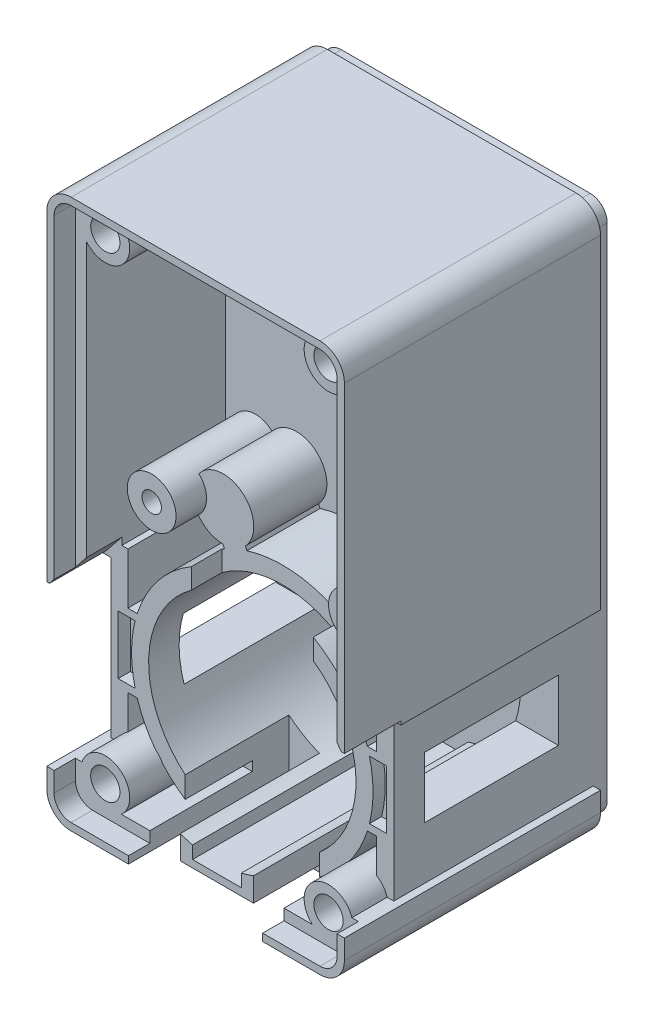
SolidWorks part; units mm, degrees
ref_plane "Face" through (0, 0, 0) normal (0, 0, 1) x (1, 0, 0)
ref_plane "Dessus" through (0, 0, 0) normal (0, 1, 0) x (1, 0, 0)
ref_plane "Droite" through (0, 0, 0) normal (1, 0, 0) x (0, 0, -1)
imported_body "Importée1"
sketch "Esquisse1" plane through (0, 0, 10.3) normal (0, 0, 1) x (1, 0, 0)
  line L6 (12.2, -29.4) -> (11.6, -29.4)
  line L7 (11.6, -29.4) -> (11.6, -31)
  line L8 (10.2, -32.4) -> (5.5, -32.4)
  line L9 (5.5, -32.4) -> (5.5, -33)
  line L10 (-10.2, 11.4) -> (10.2, 11.4)
  line L11 (11.6, 10) -> (11.6, -15.8399)
  line L12 (11.6, -15.8399) -> (11.9681, -16.3)
  line L13 (11.9681, -16.3) -> (12.2, -16.3)
  line L14 (12.2, -16.3) -> (12.2, 10)
  line L15 (10.2, 12) -> (-10.2, 12)
  line L16 (-12.2, 10) -> (-12.2, -16.3)
  line L17 (-12.2, -16.3) -> (-11.9681, -16.3)
  line L18 (-11.9681, -16.3) -> (-11.6, -15.8399)
  line L19 (-11.6, -15.8399) -> (-11.6, 10)
  line L20 (-10.2, 11.4) -> (10.2, 11.4)
  line L21 (11.6, 10) -> (11.6, -15.8399)
  line L22 (11.6, -15.8399) -> (11.9681, -16.3)
  line L23 (11.9681, -16.3) -> (12.2, -16.3)
  line L24 (12.2, -16.3) -> (12.2, 10)
  line L25 (10.2, 12) -> (-10.2, 12)
  line L26 (-12.2, 10) -> (-12.2, -16.3)
  line L27 (-12.2, -16.3) -> (-11.9681, -16.3)
  line L28 (-11.9681, -16.3) -> (-11.6, -15.8399)
  line L29 (-11.6, -15.8399) -> (-11.6, 10)
  line L30 (5.5, -33) -> (10.2, -33)
  line L31 (12.2, -31) -> (12.2, -29.4)
  line L32 (12.2, -29.4) -> (11.6, -29.4)
  line L33 (11.6, -29.4) -> (11.6, -31)
  line L34 (10.2, -32.4) -> (5.5, -32.4)
  line L35 (5.5, -32.4) -> (5.5, -33)
  line L36 (5.5, -33) -> (10.2, -33)
  line L37 (12.2, -31) -> (12.2, -29.4)
  line L38 (-11.6, -29.4) -> (-12.2, -29.4)
  line L39 (-12.2, -29.4) -> (-12.2, -31)
  line L40 (-10.2, -33) -> (-5.5, -33)
  line L41 (-5.5, -33) -> (-5.5, -32.4)
  line L42 (-5.5, -32.4) -> (-10.2, -32.4)
  line L43 (-11.6, -31) -> (-11.6, -29.4)
  line L44 (-11.6, -29.4) -> (-12.2, -29.4)
  line L45 (-12.2, -29.4) -> (-12.2, -31)
  line L46 (-10.2, -33) -> (-5.5, -33)
  line L47 (-5.5, -33) -> (-5.5, -32.4)
  line L48 (-5.5, -32.4) -> (-10.2, -32.4)
  line L49 (-11.6, -31) -> (-11.6, -29.4)
  arc A2 (10.2, -32.4) -> (11.6, -31) centre (10.2, -31) ccw
  arc A3 (10.2, -33) -> (12.2, -31) centre (10.2, -31) ccw
  arc A4 (-10.2, 11.4) -> (-11.6, 10) centre (-10.2, 10) ccw
  arc A5 (11.6, 10) -> (10.2, 11.4) centre (10.2, 10) ccw
  arc A6 (12.2, 10) -> (10.2, 12) centre (10.2, 10) ccw
  arc A7 (-10.2, 12) -> (-12.2, 10) centre (-10.2, 10) ccw
  arc A8 (-10.2, 11.4) -> (-11.6, 10) centre (-10.2, 10) ccw
  arc A9 (11.6, 10) -> (10.2, 11.4) centre (10.2, 10) ccw
  arc A10 (12.2, 10) -> (10.2, 12) centre (10.2, 10) ccw
  arc A11 (-10.2, 12) -> (-12.2, 10) centre (-10.2, 10) ccw
  arc A12 (10.2, -32.4) -> (11.6, -31) centre (10.2, -31) ccw
  arc A13 (10.2, -33) -> (12.2, -31) centre (10.2, -31) ccw
  arc A14 (-12.2, -31) -> (-10.2, -33) centre (-10.2, -31) ccw
  arc A15 (-11.6, -31) -> (-10.2, -32.4) centre (-10.2, -31) ccw
  arc A16 (-12.2, -31) -> (-10.2, -33) centre (-10.2, -31) ccw
  arc A17 (-11.6, -31) -> (-10.2, -32.4) centre (-10.2, -31) ccw
  dimension "D1" = 0
  dimension "D2" = 0
  dimension "D3" = 0
extrude "Extrusion1" add sketch "Esquisse1" along normal blind 0.15
sketch "Esquisse2" plane through (0, 0, -10.4) normal (0, 0, -1) x (-1, 0, 0)
  line L8 (10.2, 12) -> (-10.2, 12)
  line L9 (-12.2, 10) -> (-12.2, -16.6)
  line L10 (-12.2, -16.6) -> (-11.6, -16.6)
  line L11 (-11.6, -16.6) -> (-11.6, 10)
  line L12 (-10.2, 11.4) -> (10.2, 11.4)
  line L13 (11.6, 10) -> (11.6, -16.6)
  line L14 (11.6, -16.6) -> (12.2, -16.6)
  line L15 (12.2, -16.6) -> (12.2, 10)
  line L16 (10.2, 12) -> (-10.2, 12)
  line L17 (-12.2, 10) -> (-12.2, -16.6)
  line L18 (-12.2, -16.6) -> (-11.6, -16.6)
  line L19 (-11.6, -16.6) -> (-11.6, 10)
  line L20 (-10.2, 11.4) -> (10.2, 11.4)
  line L21 (11.6, 10) -> (11.6, -16.6)
  line L22 (11.6, -16.6) -> (12.2, -16.6)
  line L23 (12.2, -16.6) -> (12.2, 10)
  line L24 (10.2, -32.4) -> (-10.2, -32.4)
  line L25 (-11.6, -31) -> (-11.6, -29.4)
  line L26 (-11.6, -29.4) -> (-12.2, -29.4)
  line L27 (-12.2, -29.4) -> (-12.2, -31)
  line L28 (-10.2, -33) -> (10.2, -33)
  line L29 (12.2, -31) -> (12.2, -29.4)
  line L30 (12.2, -29.4) -> (11.6, -29.4)
  line L31 (11.6, -29.4) -> (11.6, -31)
  line L32 (10.2, -32.4) -> (-10.2, -32.4)
  line L33 (-11.6, -31) -> (-11.6, -29.4)
  line L34 (-11.6, -29.4) -> (-12.2, -29.4)
  line L35 (-12.2, -29.4) -> (-12.2, -31)
  line L36 (-10.2, -33) -> (10.2, -33)
  line L37 (12.2, -31) -> (12.2, -29.4)
  line L38 (12.2, -29.4) -> (11.6, -29.4)
  line L39 (11.6, -29.4) -> (11.6, -31)
  arc A4 (12.2, 10) -> (10.2, 12) centre (10.2, 10) ccw
  arc A5 (-10.2, 12) -> (-12.2, 10) centre (-10.2, 10) ccw
  arc A6 (-10.2, 11.4) -> (-11.6, 10) centre (-10.2, 10) ccw
  arc A7 (11.6, 10) -> (10.2, 11.4) centre (10.2, 10) ccw
  arc A8 (12.2, 10) -> (10.2, 12) centre (10.2, 10) ccw
  arc A9 (-10.2, 12) -> (-12.2, 10) centre (-10.2, 10) ccw
  arc A10 (-10.2, 11.4) -> (-11.6, 10) centre (-10.2, 10) ccw
  arc A11 (11.6, 10) -> (10.2, 11.4) centre (10.2, 10) ccw
  arc A12 (10.2, -32.4) -> (11.6, -31) centre (10.2, -31) ccw
  arc A13 (-11.6, -31) -> (-10.2, -32.4) centre (-10.2, -31) ccw
  arc A14 (-12.2, -31) -> (-10.2, -33) centre (-10.2, -31) ccw
  arc A15 (10.2, -33) -> (12.2, -31) centre (10.2, -31) ccw
  arc A16 (10.2, -32.4) -> (11.6, -31) centre (10.2, -31) ccw
  arc A17 (-11.6, -31) -> (-10.2, -32.4) centre (-10.2, -31) ccw
  arc A18 (-12.2, -31) -> (-10.2, -33) centre (-10.2, -31) ccw
  arc A19 (10.2, -33) -> (12.2, -31) centre (10.2, -31) ccw
  dimension "D1" = 0
  dimension "D2" = 0
extrude "Extrusion2" add sketch "Esquisse2" along normal blind 0.15
